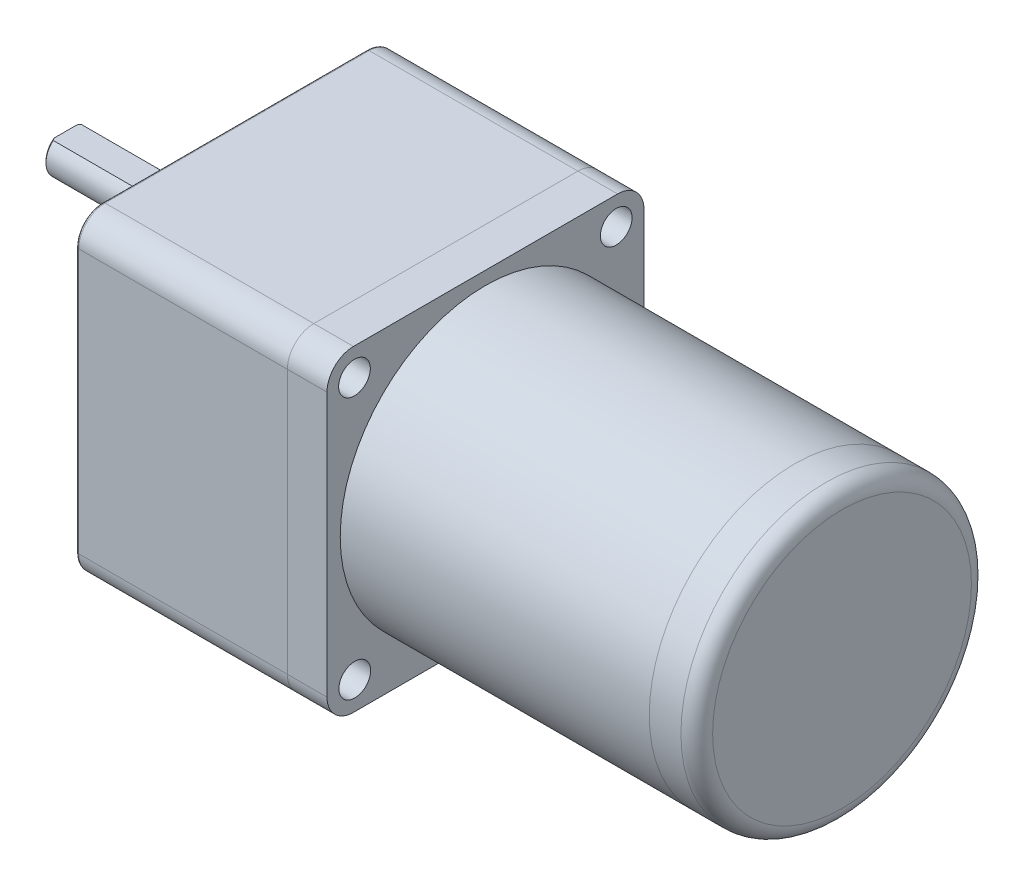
SolidWorks part; units mm, degrees
ref_plane "前视基准面" through (0, 0, 0) normal (0, 0, 1) x (1, 0, 0)
ref_plane "上视基准面" through (0, 0, 0) normal (0, 1, 0) x (1, 0, 0)
ref_plane "右视基准面" through (0, 0, 0) normal (1, 0, 0) x (0, 0, -1)
sketch "草图1" plane through (0, 0, 0) normal (1, 0, 0) x (0, 0, -1)
  line L1 (-25, -30) -> (25, -30)
  line L2 (-30, -25) -> (-30, 25)
  line L3 (-25, 30) -> (25, 30)
  line L4 (30, -25) -> (30, 25)
  line L5 (-30, -30) -> (30, 30) construction
  line L6 (-30, 30) -> (30, -30) construction
  arc A0 (-25, -30) -> (-30, -25) centre (-25, -25) cw
  arc A1 (25, -30) -> (30, -25) centre (25, -25) ccw
  arc A2 (25, 30) -> (30, 25) centre (25, 25) cw
  arc A3 (-30, 25) -> (-25, 30) centre (-25, 25) cw
  point P0 (0, 0)
  dimension "D1" = 5
extrude "凸台-拉伸1" add sketch "草图1" along normal blind 40
sketch "草图2" plane through (40, 0, 0) normal (1, 0, 0) x (0, 0, -1)
  line L0 (25, 30) -> (-25, 30) construction
  line L1 (-25, -30) -> (25, -30)
  line L2 (-30, -25) -> (-30, 25)
  line L3 (-25, 30) -> (25, 30)
  line L4 (30, -25) -> (30, 25)
  line L5 (-30, -30) -> (30, 30) construction
  line L6 (-30, 30) -> (30, -30) construction
  arc A0 (25, 30) -> (30, 25) centre (25, 25) cw
  arc A1 (25, -30) -> (30, -25) centre (25, -25) ccw
  arc A2 (-25, -30) -> (-30, -25) centre (-25, -25) cw
  arc A3 (-30, 25) -> (-25, 30) centre (-25, 25) cw
  point P0 (0, 0)
  dimension "D1" = 5
extrude "凸台-拉伸2" add sketch "草图2" along normal blind 7.5 separate body
sketch "草图3" plane through (47.5, 0, 0) normal (1, 0, 0) x (0, 0, -1)
  circle A0 centre (0, 0) radius 27.5
extrude "凸台-拉伸3" add sketch "草图3" along normal blind 58.5 separate body
sketch "草图4" plane through (106, 0, 0) normal (1, 0, 0) x (0, 0, -1)
  circle A0 centre (0, 0) radius 27.5
extrude "凸台-拉伸4" add sketch "草图4" along normal blind 9 separate body
fillet "圆角1" radius 3 1 edges at (115, 0, -27.5)
sketch "草图5" plane through (0, 0, 0) normal (-1, 0, 0) x (0, 0, 1)
  circle A0 centre (0, 10) radius 12
extrude "凸台-拉伸5" add sketch "草图5" along normal blind 3 separate body
sketch "草图6" plane through (-3, 0, 0) normal (-1, 0, 0) x (0, 0, 1)
  circle A0 centre (0, 10) radius 4
extrude "凸台-拉伸6" add sketch "草图6" along normal blind 29 separate body
fillet "圆角2" radius 0.5 1 edges at (-3, 10, 12)
sketch "草图7" plane through (-32, 0, 0) normal (-1, 0, 0) x (0, 0, 1)
  line L2 (2.6458, 13) -> (-2.6458, 13)
  arc A0 (2.6458, 13) -> (-2.6458, 13) centre (0, 10) ccw
extrude "切除-拉伸1" cut sketch "草图7" against normal blind 25
chamfer "倒角1" distance 0.3 angle 45 1 edges at (-32, 6, 0)
sketch "草图8" plane through (0, 0, 0) normal (-1, 0, 0) x (0, 0, 1)
  circle A0 centre (0, 0) radius 26.3
extrude "切除-拉伸2" cut sketch "草图8" against normal blind 0.5
fillet "圆角3" radius 0.5 1 edges at (0, 0, 26.3)
fillet "圆角4" radius 0.5 8 edges at (0, -30, 0) (0, -28.5355, -28.5355) (0, 0, -30) (0, 28.5355, -28.5355) (0, 30, 0) (0, 28.5355, 28.5355) (0, 0, 30) (0, -28.5355, 28.5355)
sketch "草图9" plane through (0, 0, 0) normal (-1, 0, 0) x (0, 0, 1)
  point P19 (-24.7487, 24.7487)
  point P20 (24.7487, 24.7487)
  point P21 (24.7487, -24.7487)
  point P22 (-24.7487, -24.7487)
hole_wizard "M4 螺纹孔1" positions "3D草图1" profile "草图10" tap size "M4" standard "GB"
sketch3d "3D草图1"
  point P0 (0, 24.7487, -24.7487)
  point P3 (0, 24.7487, 24.7487)
  point P6 (0, -24.7487, 24.7487)
  point P9 (0, -24.7487, -24.7487)
sketch "草图10" plane through (0, 24.7487, -24.7487) normal (0, 1, 0) x (0, 0, 1)
  line L0 (0, 0) -> (0, 12.9914)
  line L1 (0, 12.9914) -> (1.65, 12)
  line L2 (1.65, 12) -> (1.65, 0)
  line L5 (1.65, 0) -> (0, 0)
  line L10 (0, 12.9914) -> (-1.65, 12) construction
  line L11 (0, -6.35) -> (0, 107.95) construction
  dimension "螺纹孔钻头直径" = 3.3
  dimension "螺纹孔钻头深度" = 12
  dimension "导头角度" = 118
sketch "草图11" plane through (47.5, 0, 0) normal (1, 0, 0) x (0, 0, -1)
  circle A5 centre (-24.8007, 24.8007) radius 3
  circle A6 centre (24.7487, 24.7487) radius 3
  circle A7 centre (24.7487, -24.7487) radius 3
  circle A8 centre (-24.7487, -24.7487) radius 3
extrude "切除-拉伸3" cut sketch "草图11" against normal blind 33
